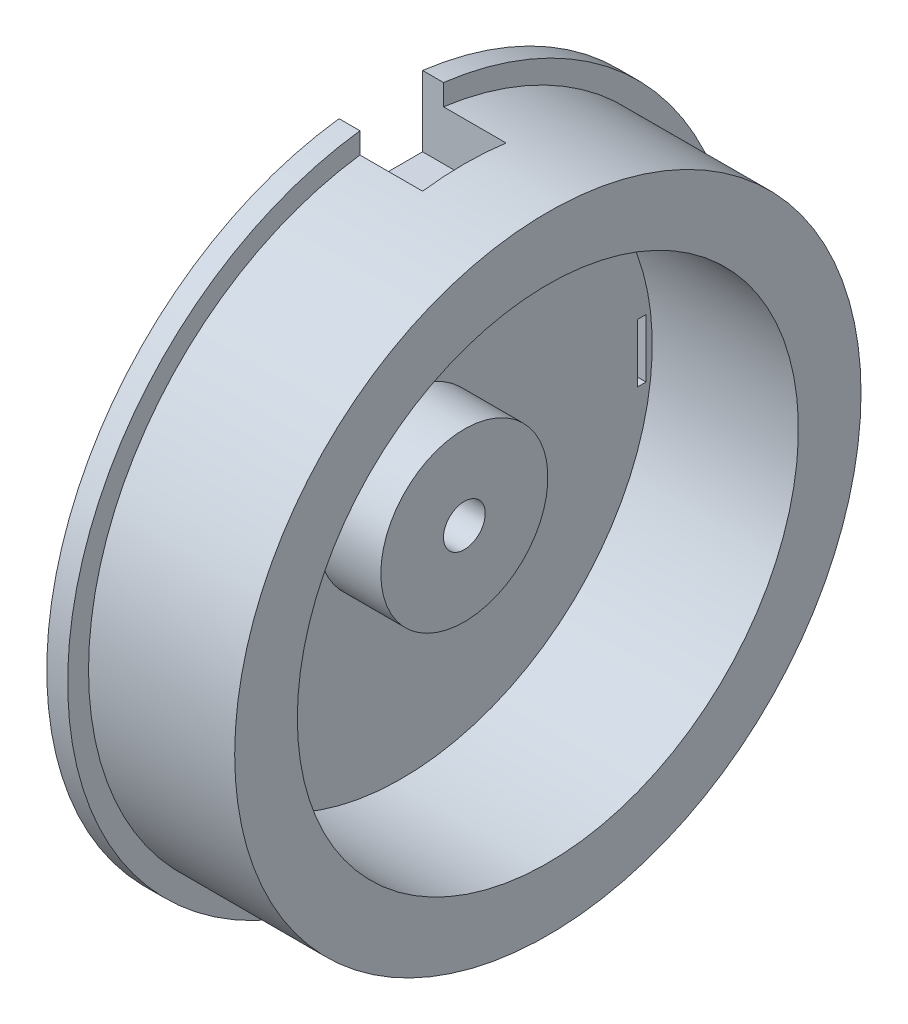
SolidWorks part; units mm, degrees
ref_plane "FACE" through (0, 0, 0) normal (0, 0, 1) x (1, 0, 0)
ref_plane "DESSUS" through (0, 0, 0) normal (0, 1, 0) x (1, 0, 0)
ref_plane "GAUCHE" through (0, 0, 0) normal (1, 0, 0) x (0, 0, -1)
sketch "Esquisse1" plane through (0, 0, 0) normal (0, 0, 1) x (1, 0, 0)
  line L0 (0, 0) -> (30, 0) construction
  line L1 (0, 4) -> (0, 16)
  line L2 (0, 16) -> (1, 16)
  line L3 (1, 16) -> (1, 15)
  line L4 (1, 15) -> (8, 15)
  line L5 (8, 15) -> (8, 12)
  line L6 (8, 12) -> (1, 12)
  line L7 (1, 12) -> (1, 4)
  line L8 (1, 4) -> (4, 4)
  line L9 (4, 4) -> (4, 1)
  line L10 (4, 1) -> (-1, 1)
  line L11 (-1, 1) -> (-1, 4)
  line L12 (-1, 4) -> (0, 4)
  line L13 (12.489, 0.1077) -> (42.489, 0.1077) construction
  dimension "D1" = 8
  dimension "D2" = 1
  dimension "D3" = 32
  dimension "D4" = 30
  dimension "D5" = 24
  dimension "D6" = 1
  dimension "D7" = 1
  dimension "D8" = 8
  dimension "D9" = 3
revolve "Base-Révolution" add sketch "Esquisse1" angle 360 about L0
sketch "Esquisse2" plane through (0, 0, 0) normal (-1, 0, 0) x (0, 0, 1)
  line L0 (-2, 15.8745) -> (-2, 12.5)
  line L1 (-2, 12.5) -> (2, 12.5)
  line L2 (2, 12.5) -> (2, 15.8745)
  circle A0 centre (0, 0) radius 16 construction
  arc A1 (2, 15.8745) -> (-2, 15.8745) centre (0, 0) ccw
  dimension "D1" = 12.5
  dimension "D2" = 4
  dimension "D3" = 2
extrude "Enlèv. mat.-Extru.1" cut sketch "Esquisse2" against normal blind 4
pattern_circular "Répétition circulaire1" count 2 every 180 about axis through (0, 0, 0) along (1, 0, 0)
sketch "Esquisse3" plane through (0, 0, 0) normal (-1, 0, 0) x (0, 0, 1)
  line L1 (11.3, 1.4) -> (11.7, 1.4)
  line L2 (11.3, 1.4) -> (11.3, -1.4)
  line L3 (11.3, -1.4) -> (11.7, -1.4)
  line L4 (11.7, 1.4) -> (11.7, -1.4)
  dimension "D1" = 11.7
  dimension "D2" = 0.4
  dimension "D3" = 2.8
  dimension "D4" = 1.4
extrude "Enlèv. mat.-Extru.2" cut sketch "Esquisse3" against normal through all
pattern_circular "Répétition circulaire2" count 2 every 180 about axis through (0, 0, 0) along (1, 0, 0)
